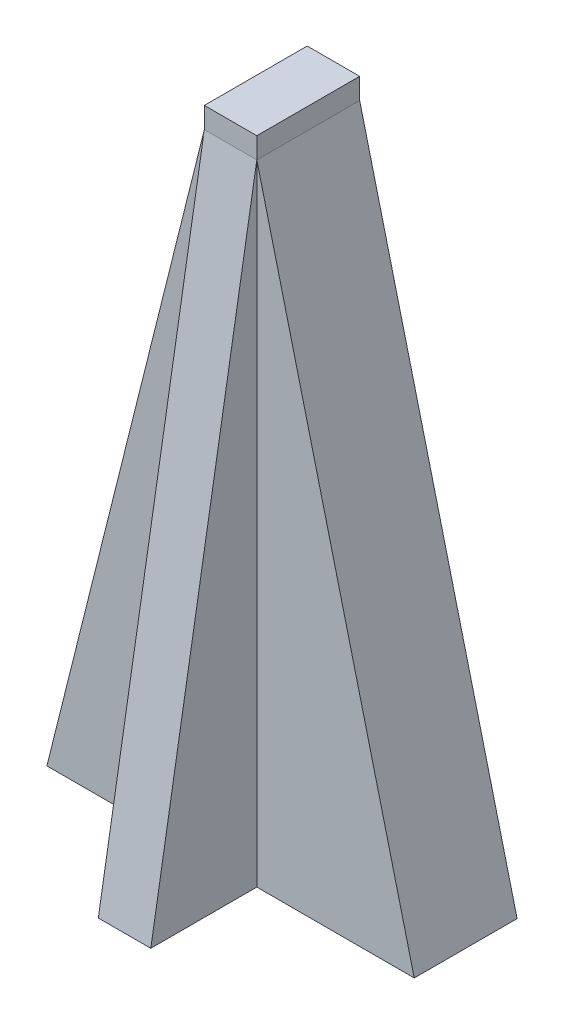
SolidWorks part; units mm, degrees
ref_plane "Front Plane" through (0, 0, 0) normal (0, 0, 1) x (1, 0, 0)
ref_plane "Top Plane" through (0, 0, 0) normal (0, 1, 0) x (1, 0, 0)
ref_plane "Right Plane" through (0, 0, 0) normal (1, 0, 0) x (0, 0, -1)
sketch "Sketch2" plane through (0, 0, 0) normal (0, 1, 0) x (1, 0, 0)
  line L1 (-6.35, -12.446) -> (6.35, -12.446)
  line L2 (-6.35, -12.446) -> (-6.35, 12.446)
  line L3 (-6.35, 12.446) -> (6.35, 12.446)
  line L4 (6.35, -12.446) -> (6.35, 12.446)
  line L5 (-6.35, -12.446) -> (6.35, 12.446) construction
  line L6 (-6.35, 12.446) -> (6.35, -12.446) construction
  point P0 (0, 0)
  dimension "D1" = 24.892
  dimension "D2" = 12.7
extrude "Boss-Extrude1" add sketch "Sketch2" along normal blind 5.08
sketch "Sketch3" plane through (0, 0, 0) normal (1, 0, 0) x (0, 0, -1)
  line L0 (-12.446, 0) -> (12.446, 0)
  line L2 (0, -152.4) -> (-38.1, -152.4)
  line L3 (-38.1, -152.4) -> (-12.446, 0)
  line L4 (0, -152.4) -> (38.1, -152.4)
  line L5 (38.1, -152.4) -> (12.446, 0)
  dimension "D1" = 38.1
  dimension "D2" = 38.1
extrude "Boss-Extrude2" add sketch "Sketch3" along normal mid plane 12.7 contours L3 L0 L5 L4 L2
sketch "Sketch4" plane through (0, 0, 0) normal (0, 0, 1) x (1, 0, 0)
  line L0 (-6.35, -152.4) -> (-44.45, -152.4)
  line L1 (-44.45, -152.4) -> (-6.35, 0)
  line L2 (-6.35, 0) -> (-6.35, -152.4)
  line L3 (0, -1000) -> (0, 49000) construction
  line L4 (44.45, -152.4) -> (6.35, 0)
  line L5 (6.35, -152.4) -> (44.45, -152.4)
  line L6 (6.35, 0) -> (6.35, -152.4)
  dimension "D1" = 38.1
extrude "Boss-Extrude3" add sketch "Sketch4" along normal mid plane 24.892 contours L1 L2 L0 | L4 L6 L5
shell "Shell1" thickness 5.08
